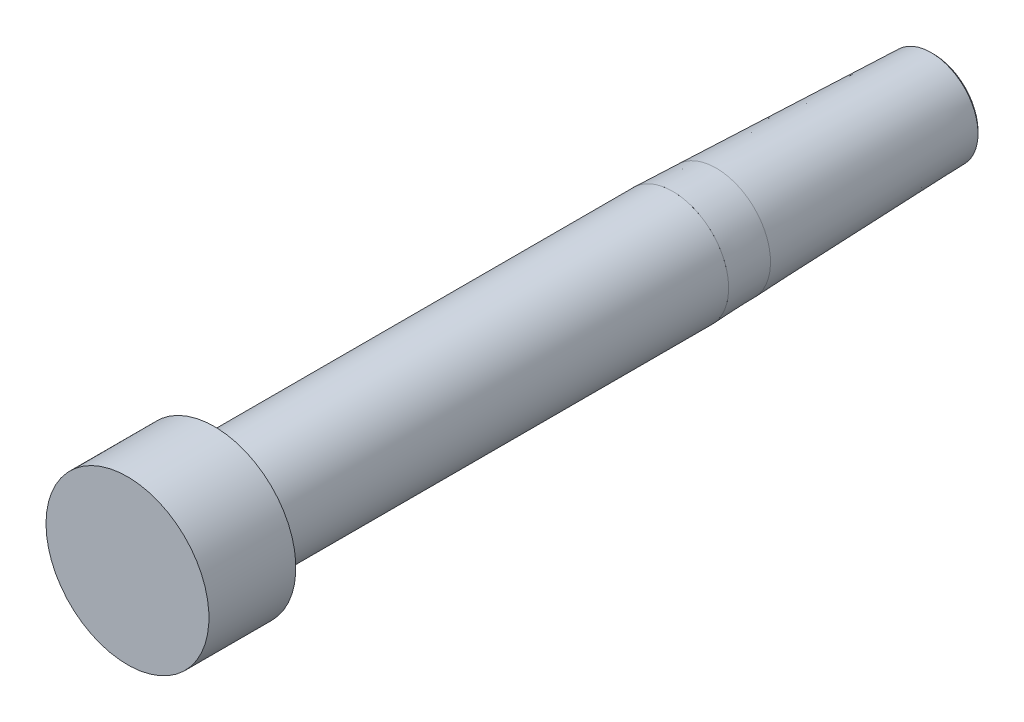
SolidWorks part; units mm, degrees
ref_plane "Plan de face" through (0, 0, 0) normal (0, 0, 1) x (1, 0, 0)
ref_plane "Plan de dessus" through (0, 0, 0) normal (0, 1, 0) x (1, 0, 0)
ref_plane "Plan de droite" through (0, 0, 0) normal (1, 0, 0) x (0, 0, -1)
sketch "Esquisse2" plane through (0, 0, -4) normal (0, 0, 1) x (1, 0, 0)
  circle A0 centre (-5.5, 49.3509) radius 2.57 construction
  circle A1 centre (-5.5, 49.3509) radius 2.57
extrude "Boss.-Extru.1" add sketch "Esquisse2" against normal up to body separate body
sketch "Esquisse3" plane through (0, 0, -4) normal (0, 0, 1) x (1, 0, 0)
  circle A0 centre (-5.5, 49.3509) radius 3.75
  dimension "D1" = 7.5
extrude "Boss.-Extru.2" add sketch "Esquisse3" along normal up to surface (4 mm away)
